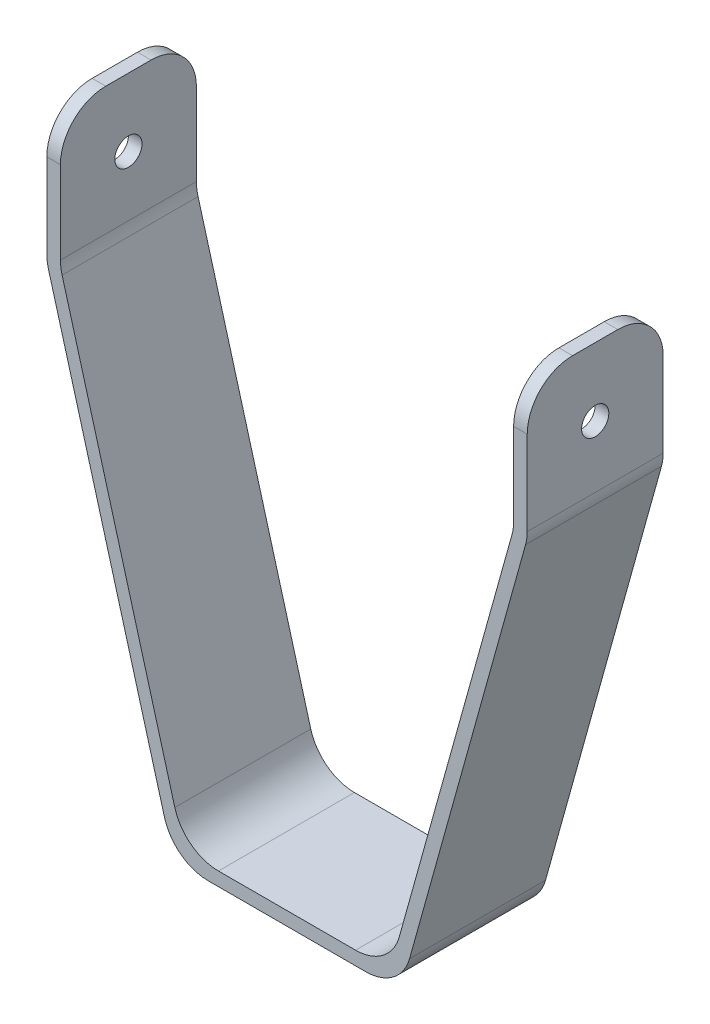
SolidWorks part; units mm, degrees
ref_plane "Plan de face" through (0, 0, 0) normal (0, 0, 1) x (1, 0, 0)
ref_plane "Plan de dessus" through (0, 0, 0) normal (0, 1, 0) x (1, 0, 0)
ref_plane "Plan de droite" through (0, 0, 0) normal (1, 0, 0) x (0, 0, -1)
sketch "Esquisse1" plane through (0, 0, 5.48) normal (0, 0, 1) x (1, 0, 0)
  line L0 (-69.2992, -1041.4099) -> (-69.2992, -1071)
  line L2 (-69.2992, -1071) -> (-42.0205, -1168.9484)
  line L3 (-42.0205, -1168.9484) -> (3.4221, -1168.9484)
  line L5 (-69.2992, -1041.4099) -> (-72.2992, -1041.4099)
  line L6 (-72.2992, -1041.4099) -> (-72.2992, -1071.4099)
  line L7 (-72.2992, -1071.4099) -> (-44.2992, -1171.9484)
  line L8 (-44.2992, -1171.9484) -> (5.7008, -1171.9484)
  line L9 (-19.2992, -1187.8945) -> (-19.2992, -1155.8812) construction
  line L10 (33.7008, -1071.4099) -> (5.7008, -1171.9484)
  line L11 (33.7008, -1041.4099) -> (33.7008, -1071.4099)
  line L12 (30.7008, -1041.4099) -> (33.7008, -1041.4099)
  line L13 (30.7008, -1071) -> (3.4221, -1168.9484)
  line L14 (30.7008, -1041.4099) -> (30.7008, -1071)
  point P16 (-19.2992, -1171.9484)
  point P20 (-19.2992, -1168.9484)
  dimension "D1" = 3
  dimension "D2" = 3
  dimension "D3" = 3
  dimension "D4" = 50
  dimension "D5" = 30
extrude "Boss.-Extru.1" add sketch "Esquisse1" along normal mid plane 30
sketch "Esquisse2" plane through (-72.2992, 0, 0) normal (-1, 0, 0) x (0, 0, 1)
  line L0 (5.48, -1041.4099) -> (5.48, -1071.4099) construction
  line L1 (20.48, -1041.4099) -> (-9.52, -1041.4099) construction
  line L2 (20.48, -1071.4099) -> (-9.52, -1071.4099) construction
  circle A0 centre (5.48, -1056.4099) radius 3
  dimension "D1" = 6
extrude "Enlèv. mat.-Extru.1" cut sketch "Esquisse2" against normal through all
fillet "Congé1" radius 10 8 edges at (-69.2992, -1071, 5.48) (-72.2992, -1071.4099, 5.48) (30.7008, -1071, 5.48) (33.7008, -1071.4099, 5.48) (-42.0205, -1168.9484, 5.48) (3.4221, -1168.9484, 5.48) (5.7008, -1171.9484, 5.48) (-44.2992, -1171.9484, 5.48)
fillet "Congé2" radius 10 4 edges at (-70.7992, -1041.4099, -9.52) (32.2008, -1041.4099, -9.52) (32.2008, -1041.4099, 20.48) (-70.7992, -1041.4099, 20.48)
